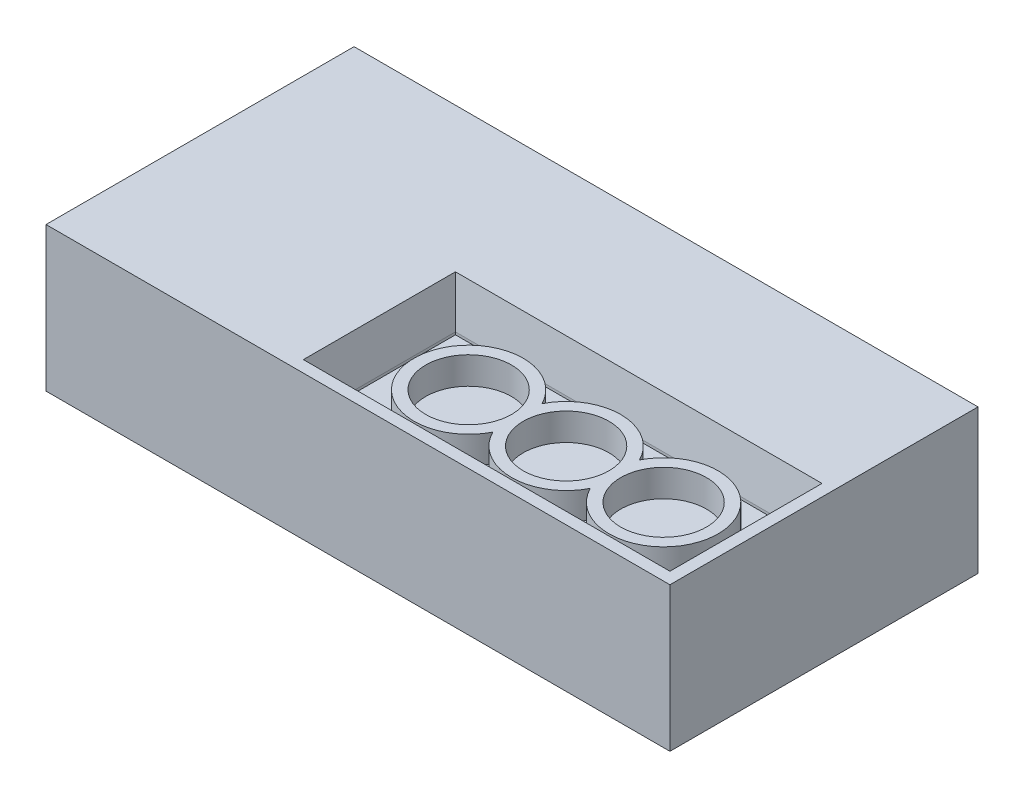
SolidWorks part; units mm, degrees
ref_plane "Front Plane" through (0, 0, 0) normal (0, 0, 1) x (1, 0, 0)
ref_plane "Top Plane" through (0, 0, 0) normal (0, 1, 0) x (1, 0, 0)
ref_plane "Right Plane" through (0, 0, 0) normal (1, 0, 0) x (0, 0, -1)
sketch "Sketch1" plane through (0, 0, 0) normal (0, 1, 0) x (1, 0, 0)
  line L1 (-80, -39.5) -> (80, -39.5)
  line L2 (-80, -39.5) -> (-80, 39.5)
  line L3 (-80, 39.5) -> (80, 39.5)
  line L4 (80, -39.5) -> (80, 39.5)
  line L5 (-80, -39.5) -> (80, 39.5) construction
  line L6 (-80, 39.5) -> (80, -39.5) construction
  point P0 (0, 0)
extrude "Boss-Extrude1" add sketch "Sketch1" along normal blind 37
sketch "Sketch2" plane through (0, 37, 0) normal (0, 1, 0) x (1, 0, 0)
  line L0 (80, -39.5) -> (80, 39.5) construction
  line L1 (75, -34.5) -> (-15, -34.5)
  line L2 (75, -34.5) -> (75, 0.5)
  line L3 (75, 0.5) -> (-15, 0.5)
  line L4 (-15, -34.5) -> (-15, 0.5)
  line L5 (-80, -39.5) -> (80, -39.5) construction
  dimension "D1" = 5
  dimension "D2" = 5
extrude "Cut-Extrude2" cut sketch "Sketch2" against normal blind 12
sketch "Sketch4" plane through (0, 25, 0) normal (0, 1, 0) x (1, 0, 0)
  circle A0 centre (55.8812, -17) radius 11
  circle A1 centre (30.8812, -17) radius 11
  circle A2 centre (5.8812, -17) radius 11
  arc A3 (43.3812, -23.3048) -> (43.3812, -10.6952) centre (55.8812, -17) ccw
  arc A4 (43.3812, -10.6952) -> (18.3812, -10.6952) centre (30.8812, -17) ccw
  arc A5 (18.3812, -10.6952) -> (18.3812, -23.3048) centre (5.8812, -17) ccw
  arc A6 (18.3812, -23.3048) -> (43.3812, -23.3048) centre (30.8812, -17) ccw
  circle A7 centre (30.8812, -17) radius 14 construction
  circle A8 centre (5.8812, -17) radius 14 construction
  circle A10 centre (55.8812, -17) radius 14 construction
  point P0 (19.8812, -17)
  point P4 (69.8812, -17)
  point P18 (44.8812, -17)
  dimension "D1" = 25
  dimension "D2" = 25
  dimension "D3" = 3
extrude "Boss-Extrude2" add sketch "Sketch4" along normal blind 7
chamfer "Chamfer1" distance 2 angle 80 4 edges at (-15, 37, 17) (30, 37, 34.5) (75, 37, 17) (30, 37, -0.5)
